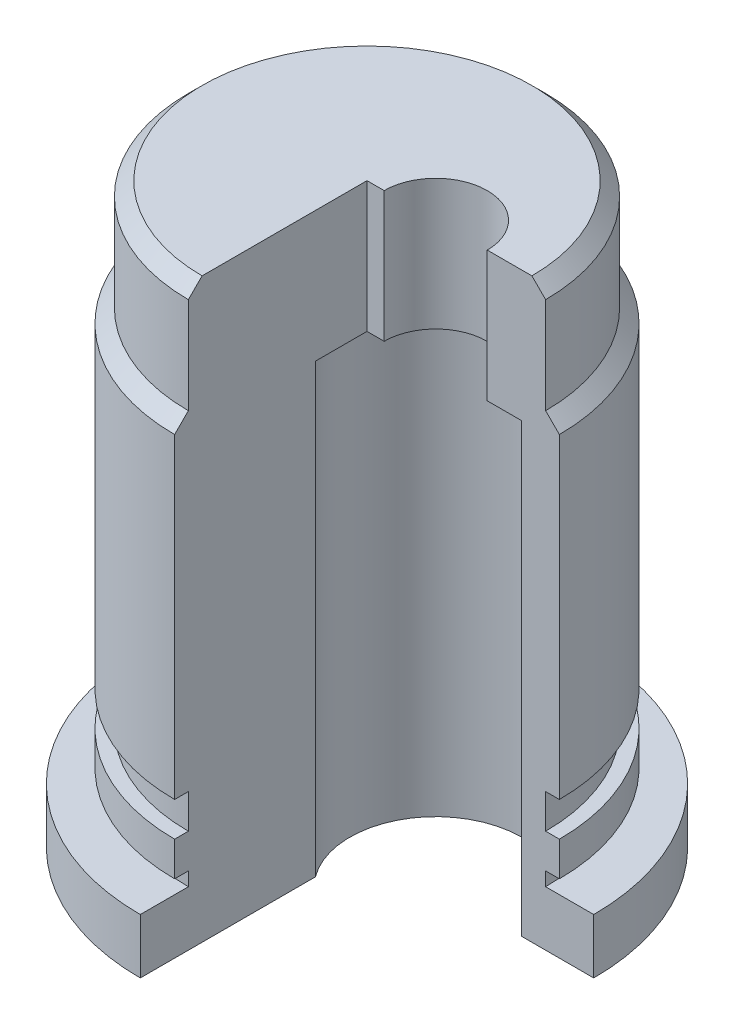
SolidWorks part; units mm, degrees
ref_plane "Plan1" through (0, 0, 0) normal (0, 0, 1) x (1, 0, 0)
ref_plane "Plan2" through (0, 0, 0) normal (0, 1, 0) x (1, 0, 0)
ref_plane "Plan3" through (0, 0, 0) normal (1, 0, 0) x (0, 0, -1)
sketch "Esquisse1" plane through (0, 0, 0) normal (0, 0, 1) x (1, 0, 0)
  line L0 (0, 84) -> (24, 84)
  line L2 (24, 84) -> (26, 82)
  line L3 (26, 82) -> (26, 68)
  line L4 (26, 68) -> (28, 66)
  line L5 (28, 66) -> (28, 20)
  line L6 (28, 20) -> (26, 20)
  line L7 (26, 20) -> (26, 15)
  line L8 (26, 15) -> (28, 15)
  line L9 (28, 15) -> (28, 10)
  line L10 (28, 10) -> (26, 10)
  line L11 (26, 10) -> (26, 8)
  line L12 (26, 8) -> (33, 8)
  line L13 (33, 8) -> (33, 0)
  line L14 (33, 0) -> (0, 0)
  line L15 (0, 0) -> (0, 84)
revolve "Révolution1" add sketch "Esquisse1" angle 360 about L15
sketch "Esquisse2" plane through (0, 0, 0) normal (0, -1, 0) x (1, 0, 0)
  circle A0 centre (10, 0) radius 12.5
  dimension "D1" = 10
extrude "Enlèv. mat.-Extru.1" cut sketch "Esquisse2" against normal blind 65
sketch "Esquisse3" plane through (0, 65, 0) normal (0, -1, 0) x (1, 0, 0)
  circle A0 centre (10, 0) radius 7.5
extrude "Enlèv. mat.-Extru.2" cut sketch "Esquisse3" against normal through all
sketch "Esquisse5" plane through (0, 84, 0) normal (0, 1, 0) x (-1, 0, 0)
  line L1 (0, 0) -> (-41.6736, 0)
  line L2 (0, 0) -> (0, 34.9471)
  line L3 (0, 34.9471) -> (-41.6736, 34.9471)
  line L4 (-41.6736, 0) -> (-41.6736, 34.9471)
extrude "Enlèv. mat.-Extru.4" cut sketch "Esquisse5" against normal through all
ref_plane "Plan médian support piston" through (0, 0, 0) normal (0, 0, 1) x (1, 0, 0)
